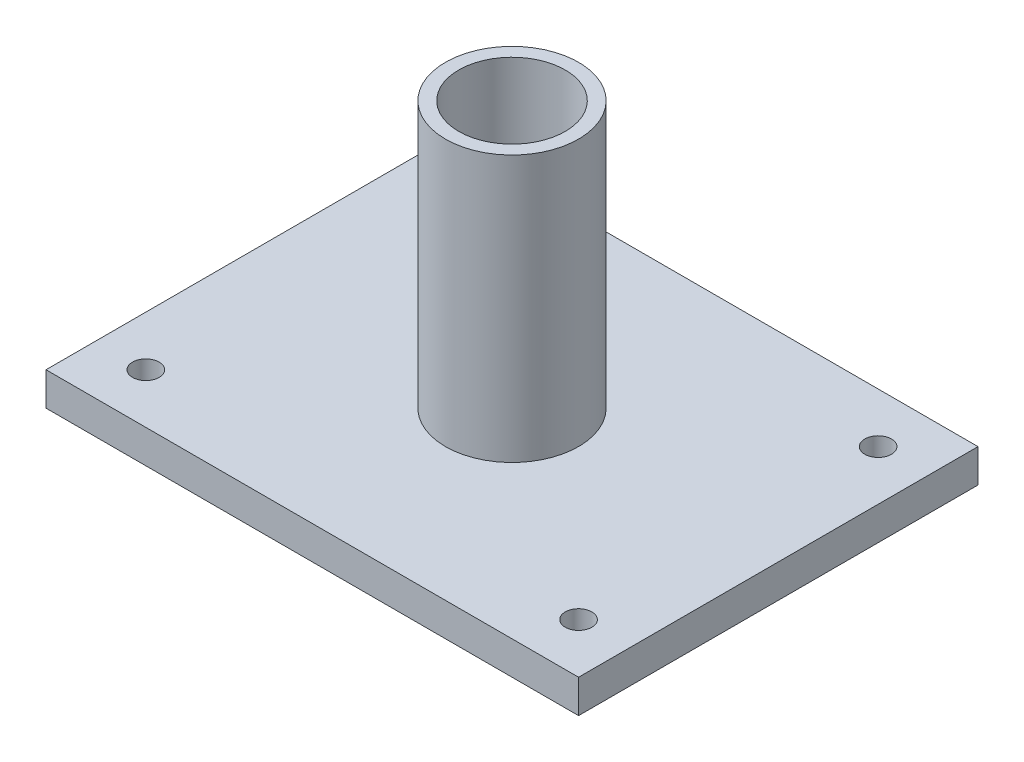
SolidWorks part; units mm, degrees
ref_plane "Front Plane" through (0, 0, 0) normal (0, 0, 1) x (1, 0, 0)
ref_plane "Top Plane" through (0, 0, 0) normal (0, 1, 0) x (1, 0, 0)
ref_plane "Right Plane" through (0, 0, 0) normal (1, 0, 0) x (0, 0, -1)
sketch "Sketch1" plane through (0, 0, 0) normal (0, 1, 0) x (1, 0, 0)
  line L1 (50.8, -38.1) -> (-50.8, -38.1)
  line L2 (50.8, -38.1) -> (50.8, 38.1)
  line L3 (50.8, 38.1) -> (-50.8, 38.1)
  line L4 (-50.8, -38.1) -> (-50.8, 38.1)
  line L5 (50.8, -38.1) -> (-50.8, 38.1) construction
  line L6 (50.8, 38.1) -> (-50.8, -38.1) construction
  point P0 (0, 0)
  dimension "D1" = 76.2
  dimension "D2" = 101.6
extrude "Boss-Extrude1" add sketch "Sketch1" along normal blind 6.35
sketch "Sketch2" plane through (0, 6.35, 0) normal (0, 1, 0) x (-1, 0, 0)
  line L0 (50.8, -38.1) -> (-50.8, 38.1) construction
  circle A0 centre (0, 0) radius 12.7
  dimension "D1" = 25.4
extrude "Cut-Extrude1" cut sketch "Sketch2" against normal through all
sketch "Sketch3" plane through (0, 6.35, 0) normal (0, 1, 0) x (1, 0, 0)
  line L4 (-50.8, 38.1) -> (-50.8, -38.1)
  line L5 (-50.8, -38.1) -> (50.8, -38.1)
  line L6 (50.8, -38.1) -> (50.8, 38.1)
  line L7 (50.8, 38.1) -> (-50.8, 38.1)
  line L8 (-50.8, 38.1) -> (-50.8, -38.1)
  line L9 (-50.8, -38.1) -> (50.8, -38.1)
  line L10 (50.8, -38.1) -> (50.8, 38.1)
  line L11 (50.8, 38.1) -> (-50.8, 38.1)
  circle A0 centre (-41.275, 28.575) radius 2.54 construction
  circle A1 centre (41.275, 28.575) radius 2.54 construction
  circle A2 centre (41.275, -28.575) radius 2.54 construction
  circle A3 centre (-41.275, -28.575) radius 2.54 construction
  circle A4 centre (-41.275, 28.575) radius 2.54
  circle A5 centre (41.275, 28.575) radius 2.54
  circle A6 centre (41.275, -28.575) radius 2.54
  circle A7 centre (-41.275, -28.575) radius 2.54
  dimension "D1" = 0
extrude "Cut-Extrude2" cut sketch "Sketch3" against normal through all contours A4 | A5 | A6 | A7
sketch "Sketch4" plane through (0, 6.35, 0) normal (0, 1, 0) x (1, 0, 0)
  line L8 (-48.26, 35.56) -> (-48.26, -35.56)
  line L9 (-48.26, -35.56) -> (48.26, -35.56)
  line L10 (48.26, -35.56) -> (48.26, 35.56)
  line L11 (48.26, 35.56) -> (-48.26, 35.56)
  line L12 (-48.26, 35.56) -> (-48.26, -35.56)
  line L13 (-48.26, -35.56) -> (48.26, -35.56)
  line L14 (48.26, -35.56) -> (48.26, 35.56)
  line L15 (48.26, 35.56) -> (-48.26, 35.56)
  circle A2 centre (0, 0) radius 10.16
  circle A3 centre (0, 0) radius 10.16
  dimension "D1" = 2.54
  dimension "D2" = 2.54
extrude "Boss-Extrude2" add sketch "Sketch4" along normal blind 50.8 and the other way up to surface (6.35 mm away) contours A3 M10
